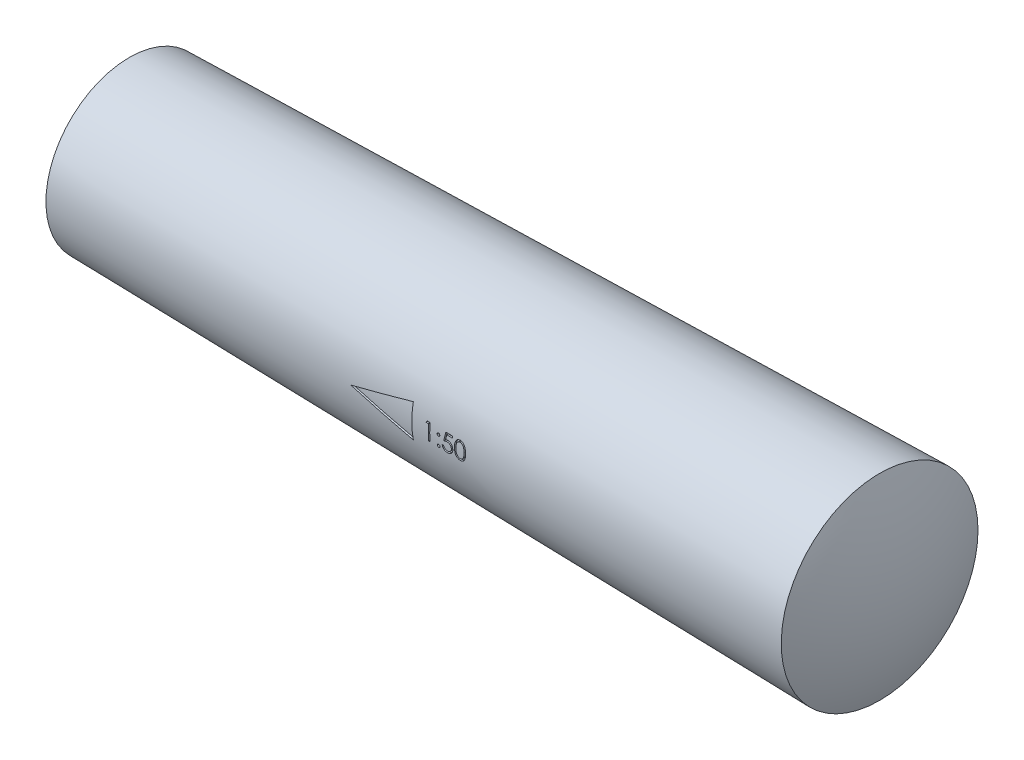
SolidWorks part; units mm, degrees
ref_plane "Front Plane" through (0, 0, 0) normal (0, 0, 1) x (1, 0, 0)
ref_plane "Top Plane" through (0, 0, 0) normal (0, 1, 0) x (1, 0, 0)
ref_plane "Right Plane" through (0, 0, 0) normal (1, 0, 0) x (0, 0, -1)
sketch "Sketch1" plane through (0, 0, 0) normal (1, 0, 0) x (0, 0, -1)
  circle A0 centre (0, 0) radius 5
  dimension "D1" = 10
extrude "Extrude1" add sketch "Sketch1" along normal mid plane 45
draft "Draft1" type of draft neutral plane draft angle 1.146 faces to draft 1 parameters "D1"=1.146
sketch "Sketch2" plane through (0, 0, 0) normal (0, 0, 1) x (1, 0, 0)
  line L0 (-22.5, 0) -> (-22.5, 5)
  line L1 (-22.5, 5) -> (-22.5, -5) construction
  line L2 (-22.5, 0) -> (-23.7, 0)
  line L3 (-23.7, 0) -> (-23.7, -5.45) construction
  line L4 (22.5, 0) -> (22.5, 5.9)
  line L5 (22.5, -5.9) -> (22.5, 5.9) construction
  line L6 (22.5, 0) -> (23.7, 0)
  line L7 (23.7, 0) -> (23.7, -5.45) construction
  line L8 (-22.5, -5) -> (22.5, -5.9) construction
  arc A0 (-23.7, 0) -> (-22.5, 5) centre (-12.6833, 0) cw
  arc A1 (23.7, 0) -> (22.5, 5.9) centre (8.5957, 0) ccw
  point P14 (0, -5.45)
revolve "Revolve1" add sketch "Sketch2" angle 360 about L2
sketch "Sketch5" plane through (0, 0, 0) normal (0, 0, 1) x (1, 0, 0)
  line L0 (0, 5.45) -> (0, -5.45) construction
  line L1 (22.5, 5.9) -> (-22.5, 5) construction
  line L2 (-22.5, -5) -> (22.5, -5.9) construction
ref_plane "Plane2" through (0, 0, 0) normal (-0.02, 0, 0.9998) x (0.9998, 0, 0.02)
sketch "Sketch6" plane through (0, 0, 0) normal (-0.02, 0, 0.9998) x (0.9998, 0, 0.02)
  line L0 (0, 0) -> (0, 1)
  line L1 (0, 5.45) -> (0, -5.45) construction
  line L2 (0, 1) -> (-3.7321, 0)
  line L3 (-3.7321, 0) -> (0, -1)
  line L4 (0, -1) -> (0, 0)
  line L5 (0, -0.5) -> (4, -0.5) construction
  text T0 "1:50" font "Century Gothic" height 1
  dimension "D1" = 2
  dimension "D2" = 30
  dimension "D3" = 4
wrap "Wrap2" sketch "Sketch6" wrap type deboss source sketch "Sketch6" thickness 0.1 parameters "D1"=0.1
equation "\"D2@Sketch2\" = \"D1@Sketch2\""
